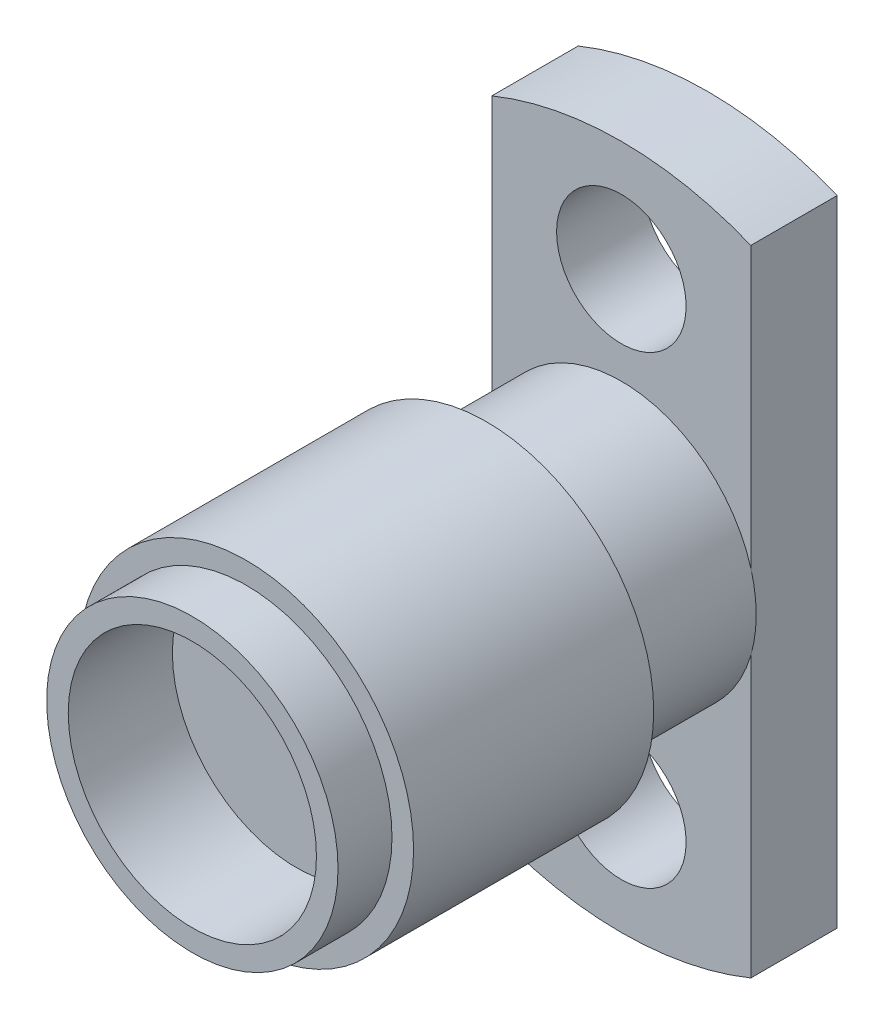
SolidWorks part; units mm, degrees
ref_plane "前视" through (0, 0, 0) normal (0, 0, 1) x (1, 0, 0)
ref_plane "上视" through (0, 0, 0) normal (0, 1, 0) x (1, 0, 0)
ref_plane "右视" through (0, 0, 0) normal (1, 0, 0) x (0, 0, -1)
sketch "草图1" plane through (0, 0, 0) normal (0, 0, 1) x (1, 0, 0)
  line L84 (15.3945, 6.4456) -> (15.3945, 19.1456)
  line L85 (7.0446, 12.7956) -> (23.7443, 12.7956)
  line L86 (12.9945, 6.9166) -> (12.9945, 18.6746)
  line L87 (17.7945, 6.9166) -> (17.7945, 18.6746)
  line L88 (25.5713, 19.1456) -> (25.5713, 6.4456)
  line L89 (25.5713, 6.4456) -> (27.1713, 6.4456)
  line L90 (27.1713, 6.4456) -> (27.1713, 19.1456)
  line L91 (27.1713, 19.1456) -> (25.5713, 19.1456)
  line L92 (34.1213, 9.6956) -> (34.1213, 15.8956)
  line L93 (34.1213, 15.8956) -> (29.6713, 15.8956)
  line L94 (29.6713, 9.6956) -> (29.6713, 15.8956)
  line L95 (34.1213, 9.6956) -> (29.6713, 9.6956)
  line L96 (27.1713, 15.4956) -> (29.6713, 15.4956)
  line L97 (27.1713, 10.0956) -> (29.6713, 10.0956)
  line L98 (34.1213, 15.4956) -> (35.1213, 15.4956)
  line L99 (34.1213, 10.0956) -> (35.1213, 10.0956)
  line L100 (35.1213, 10.0956) -> (35.1213, 15.4956)
  arc A59 (17.7945, 18.6746) -> (12.9945, 18.6746) centre (15.3945, 12.7956) ccw
  arc A60 (12.9945, 6.9166) -> (17.7945, 6.9166) centre (15.3945, 12.7956) ccw
  circle A61 centre (15.3945, 17.0956) radius 1.2
  circle A62 centre (15.3945, 8.4956) radius 1.2
  circle A63 centre (15.3945, 12.7956) radius 0.175
sketch "草图2" plane through (0, 0, 0) normal (0, 0, 1) x (1, 0, 0)
  line L0 (17.7945, 18.6746) -> (17.7945, 6.9166)
  line L1 (12.9945, 6.9166) -> (12.9945, 18.6746)
  arc A0 (17.7945, 6.9166) -> (12.9945, 6.9166) centre (15.3945, 12.7956) cw
  arc A1 (12.9945, 18.6746) -> (17.7945, 18.6746) centre (15.3945, 12.7956) cw
extrude "凸台-拉伸1" add sketch "草图2" along normal blind 1.6
sketch "草图3" plane through (0, 0, 1.6) normal (0, 0, 1) x (1, 0, 0)
  circle A0 centre (15.3945, 12.7956) radius 2.5
  dimension "D1" = 5
extrude "凸台-拉伸2" add sketch "草图3" along normal blind 2.5
sketch "草图4" plane through (0, 0, 4.1) normal (0, 0, 1) x (1, 0, 0)
  circle A0 centre (15.3945, 12.7956) radius 3.1
  dimension "D1" = 6.2
extrude "凸台-拉伸3" add sketch "草图4" along normal blind 4.45
sketch "草图5" plane through (0, 0, 8.55) normal (0, 0, 1) x (1, 0, 0)
  circle A0 centre (15.3945, 12.7956) radius 2.7
  dimension "D1" = 5.4
extrude "凸台-拉伸4" add sketch "草图5" along normal blind 1
sketch "草图6" plane through (0, 0, 0) normal (0, 0, -1) x (-1, 0, 0)
  circle A0 centre (-15.3945, 12.7956) radius 0.175
extrude "切除-拉伸1" cut sketch "草图6" against normal blind 2
sketch "草图7" plane through (0, 0, 0) normal (0, 0, -1) x (-1, 0, 0)
  circle A0 centre (-15.3945, 17.0956) radius 1.2
  circle A1 centre (-15.3945, 8.4956) radius 1.2
extrude "切除-拉伸2" cut sketch "草图7" against normal blind 2
sketch "草图8" plane through (0, 0, 9.55) normal (0, 0, 1) x (1, 0, 0)
  circle A0 centre (15.3945, 12.7956) radius 2.3
  dimension "D1" = 4.6
extrude "切除-拉伸3" cut sketch "草图8" against normal blind 1.93
sketch "草图9" plane through (0, 0, 7.62) normal (0, 0, 1) x (1, 0, 0)
  circle A0 centre (15.3945, 12.7956) radius 0.175
extrude "切除-拉伸4" cut sketch "草图9" against normal blind 2.5
